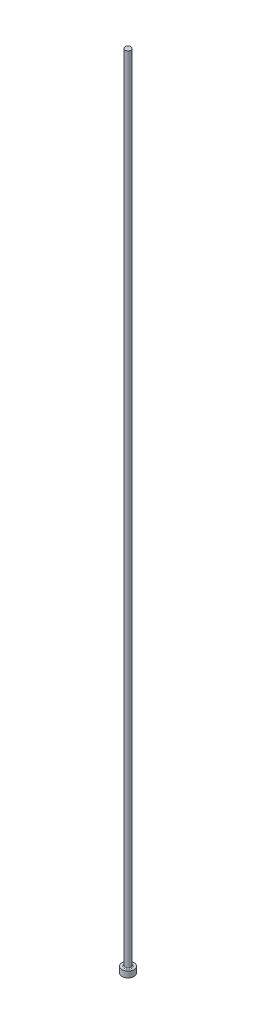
SolidWorks part; units mm, degrees
ref_plane "Plano frontal" through (0, 0, 0) normal (0, 0, 1) x (1, 0, 0)
ref_plane "Plano superior" through (0, 0, 0) normal (0, 1, 0) x (1, 0, 0)
ref_plane "Plano direito" through (0, 0, 0) normal (1, 0, 0) x (0, 0, -1)
sketch "Esboço1" plane through (0, 0, 0) normal (0, 0, 1) x (1, 0, 0)
  line L0 (0, 0) -> (1.5, 0)
  line L1 (1.5, 0) -> (1.5, 1.5)
  line L2 (1.5, 1.5) -> (0.95, 1.5)
  line L3 (0.75, 1.7) -> (0.75, 200)
  line L4 (0.75, 200) -> (0, 200)
  line L5 (0, 200) -> (0, 0) construction
  line L6 (0, 0) -> (0, 200)
  arc A0 (0.95, 1.5) -> (0.75, 1.7) centre (0.95, 1.7) cw
  dimension "D3" = 0.2
  dimension "D1" = 3
  dimension "D2" = 1.5
  dimension "D4" = 1.5
  dimension "D5" = 200
revolve "Revolução1" add sketch "Esboço1" angle 360 about L5
sketch "Esboço2"
  dimension "D1" = 0.1125
  dimension "D2" = 0.2625
  dimension "D3" = 0.1687
  dimension "D4" = 0.8063
wrap "Envolver1" sketch "Esboço2" wrap type deboss source sketch "Esboço2" thickness 0.1 parameters "D1"=0.1
